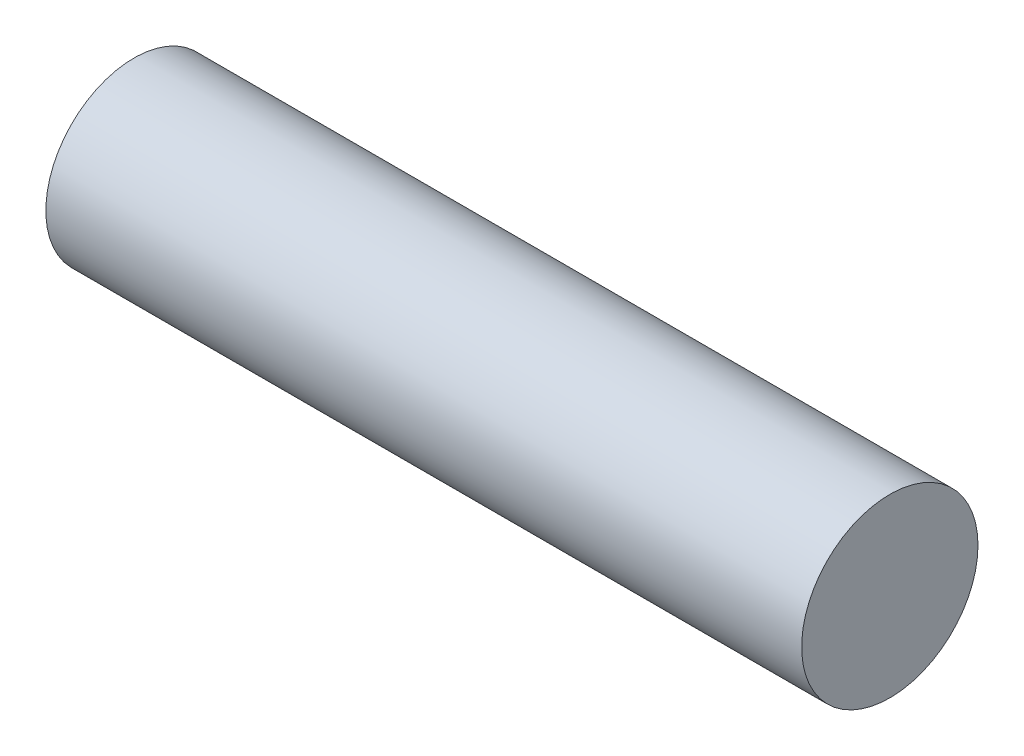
SolidWorks part; units mm, degrees
ref_plane "Front" through (0, 0, 0) normal (0, 0, 1) x (1, 0, 0)
ref_plane "Top" through (0, 0, 0) normal (0, 1, 0) x (1, 0, 0)
ref_plane "Right" through (0, 0, 0) normal (1, 0, 0) x (0, 0, -1)
sketch "Sketch1" plane through (0, 0, 0) normal (1, 0, 0) x (0, 0, -1)
  circle A0 centre (0, 0) radius 17.5
  dimension "D1" = 35
extrude "Boss-Extrude1" add sketch "Sketch1" along normal blind 150
